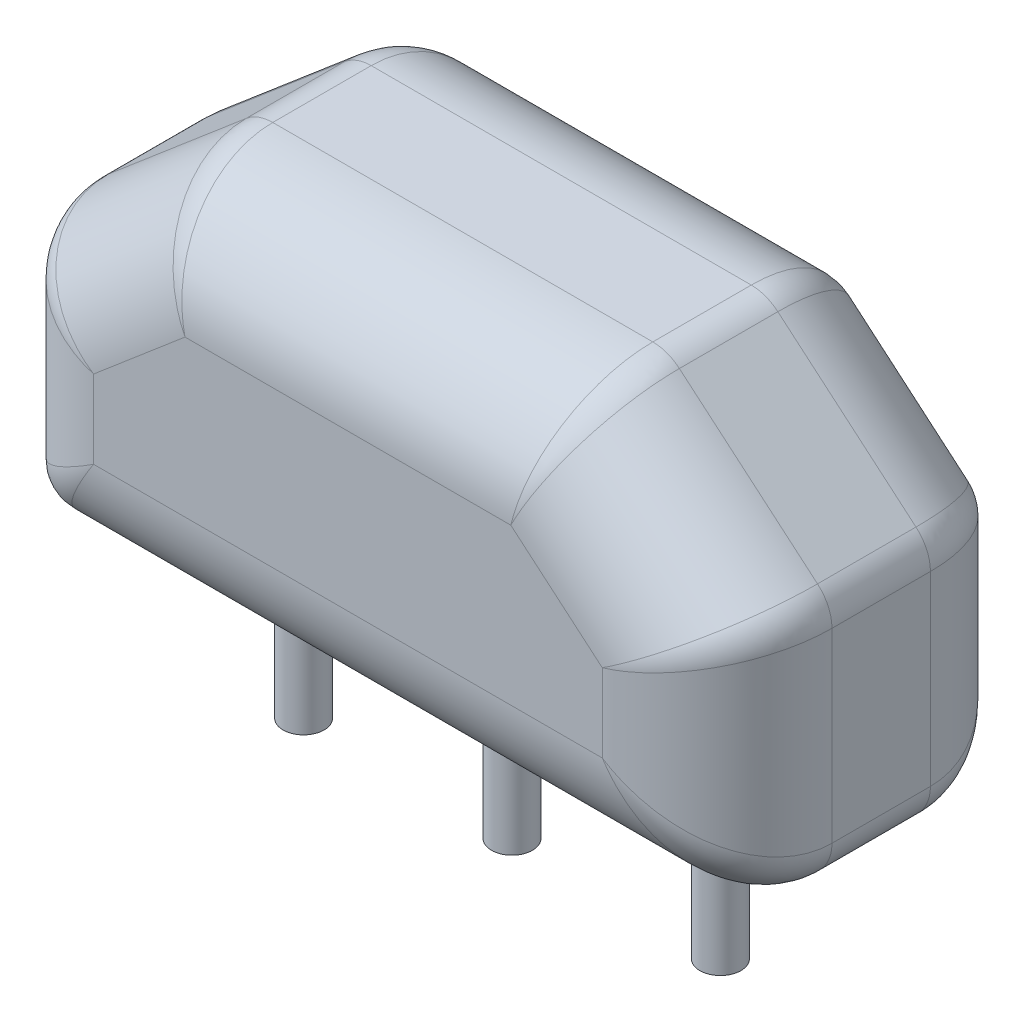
SolidWorks part; units mm, degrees
ref_plane "Plan de face" through (0, 0, 0) normal (0, 0, 1) x (1, 0, 0)
ref_plane "Plan de dessus" through (0, 0, 0) normal (0, 1, 0) x (1, 0, 0)
ref_plane "Plan de droite" through (0, 0, 0) normal (1, 0, 0) x (0, 0, -1)
sketch "Esquisse1" plane through (0, 0, 0) normal (0, 0, 1) x (1, 0, 0)
  line L0 (-27.6096, 0) -> (31.4015, 0) construction
  line L1 (0, -5.782) -> (0, 29.2686) construction
  line L2 (-4.5, 8.971) -> (-4.5, -1.3074) construction
  line L3 (-2.5, 7.2875) -> (-2.5, 2.9014) construction
  line L4 (-19.847, 4.7) -> (18.4311, 4.7) construction
  line L5 (-9.257, 3) -> (-3.559, 3) construction
  line L6 (4, 0) -> (-4, 0)
  line L7 (-4.5, 0.5) -> (-4.5, 2.7688)
  line L8 (-4.3238, 3.1497) -> (-2.64, 4.581)
  line L9 (-2.3162, 4.7) -> (2.3162, 4.7)
  line L10 (4.3238, 3.1497) -> (2.64, 4.581)
  line L11 (4.5, 0.5) -> (4.5, 2.7688)
  arc A0 (-4, 0) -> (-4.5, 0.5) centre (-4, 0.5) cw
  arc A1 (-4.5, 2.7688) -> (-4.3238, 3.1497) centre (-4, 2.7688) cw
  arc A2 (-2.64, 4.581) -> (-2.3162, 4.7) centre (-2.3162, 4.2) cw
  arc A3 (2.64, 4.581) -> (2.3162, 4.7) centre (2.3162, 4.2) ccw
  arc A4 (4.5, 2.7688) -> (4.3238, 3.1497) centre (4, 2.7688) ccw
  arc A5 (4, 0) -> (4.5, 0.5) centre (4, 0.5) ccw
  point P24 (0, 4.7)
  point P32 (0, 0)
  dimension "D5" = 0.5
  dimension "D1" = 4.5
  dimension "D2" = 4.7
  dimension "D3" = 2.5
  dimension "D4" = 3
extrude "Extrusion1" add sketch "Esquisse1" along normal blind 4
fillet "Congé1" radius 1.4 24 edges at (-4.3536, 0.1464, 0) (-4.5, 1.6344, 0) (-4.4538, 2.9786, 0) (-3.4819, 3.8654, 0) (-2.4887, 4.6693, 0) (0, 4.7, 0) (2.4887, 4.6693, 0) (3.4819, 3.8654, 0) (4.4538, 2.9786, 0) (4.5, 1.6344, 0) (4.3536, 0.1464, 0) (-4.5, 1.6344, 4) (-4.4538, 2.9786, 4) (-3.4819, 3.8654, 4) (-2.4887, 4.6693, 4) (0, 4.7, 4) (2.4887, 4.6693, 4) (3.4819, 3.8654, 4) (4.4538, 2.9786, 4) (4.5, 1.6344, 4) (4.3536, 0.1464, 4) (0, 0, 4) (-4.3536, 0.1464, 4) (0, 0, 0)
sketch "Esquisse2" plane through (0, 0, 0) normal (0, -1, 0) x (1, 0, 0)
  line L0 (0, -0.1842) -> (0, 5.3886) construction
  line L1 (5.1953, 2.6) -> (-5.0851, 2.6) construction
  line L2 (2462.6357, 2.6) -> (2453.9754, 2.6) construction
  line L3 (-2.54, 5.3886) -> (-2.54, -0.1842) construction
  line L4 (2.54, 5.3886) -> (2.54, -0.1842) construction
  line L5 (-5.0851, 2) -> (5.1953, 2) construction
  circle A0 centre (2.54, 2) radius 0.25
  circle A1 centre (0, 2) radius 0.25
  circle A2 centre (-2.54, 2) radius 0.25
  dimension "D1" = 2.54
  dimension "D2" = 2.54
  dimension "D3" = 0.6
extrude "Extrusion2" add sketch "Esquisse2" along normal blind 2
